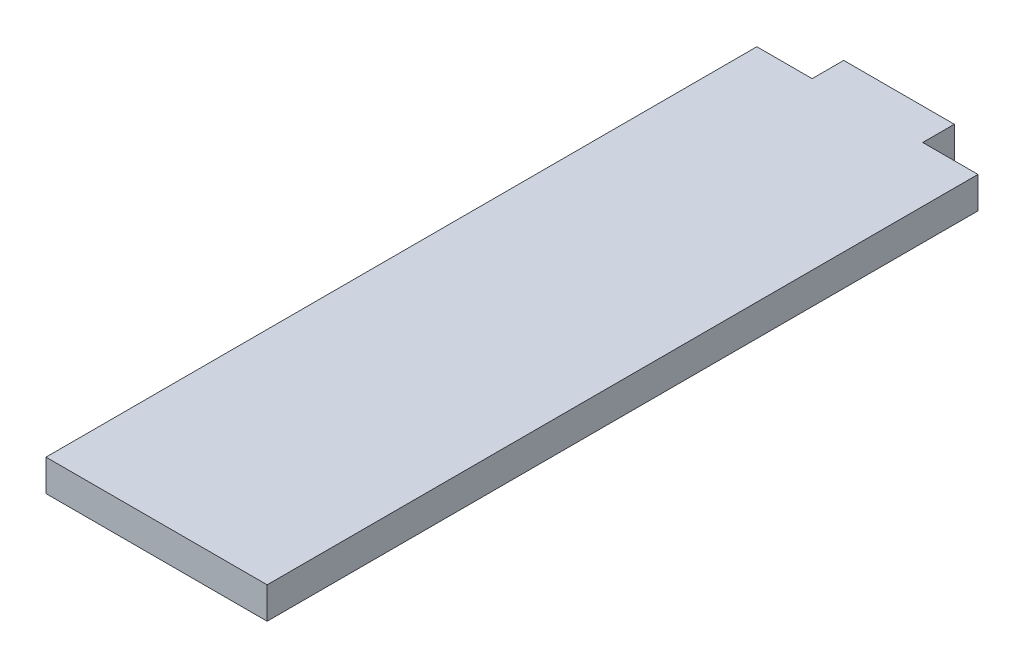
SolidWorks part; units mm, degrees
ref_plane "Front Plane" through (0, 0, 0) normal (0, 0, 1) x (1, 0, 0)
ref_plane "Top Plane" through (0, 0, 0) normal (0, 1, 0) x (1, 0, 0)
ref_plane "Right Plane" through (0, 0, 0) normal (1, 0, 0) x (0, 0, -1)
sketch "Sketch1" plane through (0, 0, 0) normal (0, 1, 0) x (1, 0, 0)
  line L0 (0, 0) -> (0, 47) construction
  line L1 (-3.5, 47) -> (3.5, 47)
  line L2 (3.5, 47) -> (3.5, 45)
  line L3 (3.5, 45) -> (7, 45)
  line L4 (7, 45) -> (7, 0)
  line L5 (7, 0) -> (-7, 0)
  line L6 (-7, 45) -> (-7, 0)
  line L7 (-3.5, 45) -> (-7, 45)
  line L8 (-3.5, 47) -> (-3.5, 45)
  dimension "D1" = 47
  dimension "D2" = 14
  dimension "D3" = 7
  dimension "D4" = 2
extrude "Boss-Extrude1" add sketch "Sketch1" along normal blind 2
